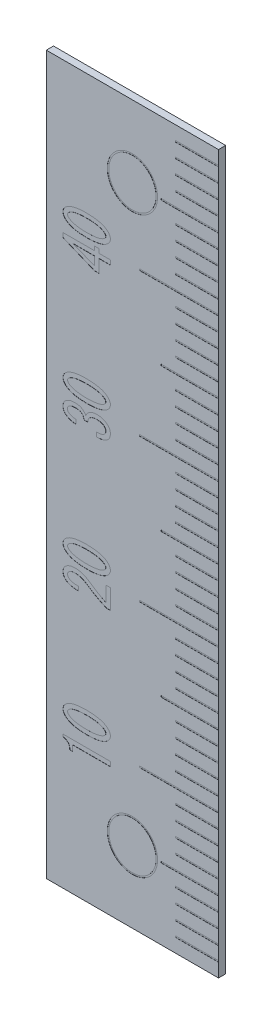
SolidWorks part; units mm, degrees
ref_plane "Front" through (0, 0, 0) normal (0, 0, 1) x (1, 0, 0)
ref_plane "Top" through (0, 0, 0) normal (0, 1, 0) x (1, 0, 0)
ref_plane "Right" through (0, 0, 0) normal (1, 0, 0) x (0, 0, -1)
sketch "Sketch1" plane through (0, 0, 0) normal (0, 0, 1) x (1, 0, 0)
  line L1 (0, 0) -> (0, 50)
  line L2 (0, 0) -> (12, 0)
  line L3 (12, 0) -> (12, 50)
  line L4 (0, 50) -> (12, 50)
  dimension "D1" = 50
  dimension "D2" = 12
extrude "Extrude1" add sketch "Sketch1" along normal blind 0.5
sketch "Sketch2" plane through (0, 0, 0.5) normal (0, 0, 1) x (1, 0, 0)
  line L0 (0, 50) -> (0, 0) construction
  line L1 (0, 0) -> (12, 0) construction
  line L2 (12, 50) -> (0, 50) construction
  circle A0 centre (6, 5) radius 1.75
  circle A1 centre (6, 45) radius 1.75
  circle A2 centre (6, 5) radius 1.65
  circle A3 centre (6, 45) radius 1.65
  dimension "D1" = 6
  dimension "D2" = 6
  dimension "D3" = 5
  dimension "D4" = 5
  dimension "D5" = 3.5
  dimension "D6" = 3.5
  dimension "D7" = 0.1
extrude "Extrude2" cut sketch "Sketch2" against normal blind 0.01
sketch "Sketch3" plane through (0, 0, 0.5) normal (0, 0, 1) x (1, 0, 0)
  line L0 (12, 50) -> (0, 50) construction
  line L1 (1, 38.25) -> (4.5, 38.25) construction
  line L2 (1, 38.25) -> (1, 41.75) construction
  line L3 (1, 41.75) -> (4.5, 41.75) construction
  line L4 (4.5, 38.25) -> (4.5, 41.75) construction
  line L5 (0, 50) -> (0, 0) construction
  line L6 (4.5, 28.25) -> (4.5, 31.75) construction
  line L7 (4.5, 18.25) -> (4.5, 21.75) construction
  line L8 (4.5, 8.25) -> (4.5, 11.75) construction
  text T0 "40" font "ＭＳ ゴシック" height in points 11
  text T1 "30  " font "ＭＳ ゴシック" height in points 11
  text T2 "20" font "ＭＳ ゴシック" height in points 11
  text T3 "10" font "ＭＳ ゴシック" height in points 11
  point P4 (4.5, 40)
  dimension "D1" = 3.5
  dimension "D2" = 10
  dimension "D3" = 1
  dimension "D4" = 3.5
  dimension "D5" = 4
extrude "Extrude3" cut sketch "Sketch3" against normal blind 0.01
sketch "Sketch4" plane through (0, 0, 0.5) normal (0, 0, 1) x (1, 0, 0)
  line L0 (12, 40.05) -> (6.5, 40.05)
  line L1 (12, 0) -> (12, 50) construction
  line L2 (6.5, 40.05) -> (6.5, 39.95)
  line L3 (6.5, 39.95) -> (12, 39.95)
  line L4 (12, 39.95) -> (12, 40.05)
  line L5 (12, 50) -> (0, 50) construction
  line L6 (12, 48.05) -> (12, 47.95)
  line L7 (12, 44.95) -> (8, 44.95)
  line L8 (12, 44.95) -> (12, 45.05)
  line L9 (12, 45.05) -> (8, 45.05)
  line L10 (8, 44.95) -> (8, 45.05)
  line L11 (12, 49.05) -> (9, 49.05)
  line L12 (12, 49.05) -> (12, 48.95)
  line L13 (12, 48.95) -> (9, 48.95)
  line L14 (9, 49.05) -> (9, 48.95)
  line L15 (12, 48.05) -> (9, 48.05)
  line L16 (12, 47.95) -> (9, 47.95)
  line L17 (9, 48.05) -> (9, 47.95)
  line L18 (12, 47.05) -> (12, 46.95)
  line L19 (12, 47.05) -> (9, 47.05)
  line L20 (12, 46.95) -> (9, 46.95)
  line L21 (9, 47.05) -> (9, 46.95)
  line L22 (12, 46.05) -> (12, 45.95)
  line L23 (12, 46.05) -> (9, 46.05)
  line L24 (12, 45.95) -> (9, 45.95)
  line L25 (9, 46.05) -> (9, 45.95)
  line L26 (12, 30.05) -> (6.5, 30.05)
  line L27 (6.5, 30.05) -> (6.5, 29.95)
  line L28 (6.5, 29.95) -> (12, 29.95)
  line L29 (12, 29.95) -> (12, 30.05)
  line L30 (12, 44.05) -> (12, 43.95)
  line L31 (12, 44.05) -> (9, 44.05)
  line L32 (12, 43.95) -> (9, 43.95)
  line L33 (9, 44.05) -> (9, 43.95)
  line L34 (12, 43.05) -> (12, 42.95)
  line L35 (12, 43.05) -> (9, 43.05)
  line L36 (12, 42.95) -> (9, 42.95)
  line L37 (9, 43.05) -> (9, 42.95)
  line L38 (12, 42.05) -> (12, 41.95)
  line L39 (12, 42.05) -> (9, 42.05)
  line L40 (12, 41.95) -> (9, 41.95)
  line L41 (9, 42.05) -> (9, 41.95)
  line L42 (12, 41.05) -> (12, 40.95)
  line L43 (12, 41.05) -> (9, 41.05)
  line L44 (12, 40.95) -> (9, 40.95)
  line L45 (9, 41.05) -> (9, 40.95)
  line L46 (9, 45.05) -> (9, 44.95)
  line L47 (12, 45.05) -> (9, 45.05)
  line L48 (12, 44.95) -> (9, 44.95)
  line L49 (12, 45.05) -> (12, 44.95)
  line L50 (12, 38.05) -> (12, 37.95)
  line L51 (12, 34.95) -> (8, 34.95)
  line L52 (12, 34.95) -> (12, 35.05)
  line L53 (12, 35.05) -> (8, 35.05)
  line L54 (8, 34.95) -> (8, 35.05)
  line L55 (12, 39.05) -> (9, 39.05)
  line L56 (12, 39.05) -> (12, 38.95)
  line L57 (12, 38.95) -> (9, 38.95)
  line L58 (9, 39.05) -> (9, 38.95)
  line L59 (12, 38.05) -> (9, 38.05)
  line L60 (12, 37.95) -> (9, 37.95)
  line L61 (9, 38.05) -> (9, 37.95)
  line L62 (12, 37.05) -> (12, 36.95)
  line L63 (12, 37.05) -> (9, 37.05)
  line L64 (12, 36.95) -> (9, 36.95)
  line L65 (9, 37.05) -> (9, 36.95)
  line L66 (12, 36.05) -> (12, 35.95)
  line L67 (12, 36.05) -> (9, 36.05)
  line L68 (12, 35.95) -> (9, 35.95)
  line L69 (9, 36.05) -> (9, 35.95)
  line L70 (12, 34.05) -> (12, 33.95)
  line L71 (12, 34.05) -> (9, 34.05)
  line L72 (12, 33.95) -> (9, 33.95)
  line L73 (9, 34.05) -> (9, 33.95)
  line L74 (12, 33.05) -> (12, 32.95)
  line L75 (12, 33.05) -> (9, 33.05)
  line L76 (12, 32.95) -> (9, 32.95)
  line L77 (9, 33.05) -> (9, 32.95)
  line L78 (12, 32.05) -> (12, 31.95)
  line L79 (12, 32.05) -> (9, 32.05)
  line L80 (12, 31.95) -> (9, 31.95)
  line L81 (9, 32.05) -> (9, 31.95)
  line L82 (12, 31.05) -> (12, 30.95)
  line L83 (12, 31.05) -> (9, 31.05)
  line L84 (12, 30.95) -> (9, 30.95)
  line L85 (9, 31.05) -> (9, 30.95)
  line L86 (12, 20.05) -> (6.5, 20.05)
  line L87 (6.5, 20.05) -> (6.5, 19.95)
  line L88 (6.5, 19.95) -> (12, 19.95)
  line L89 (12, 19.95) -> (12, 20.05)
  line L90 (12, 28.05) -> (12, 27.95)
  line L91 (12, 24.95) -> (8, 24.95)
  line L92 (12, 24.95) -> (12, 25.05)
  line L93 (12, 25.05) -> (8, 25.05)
  line L94 (8, 24.95) -> (8, 25.05)
  line L95 (12, 29.05) -> (9, 29.05)
  line L96 (12, 29.05) -> (12, 28.95)
  line L97 (12, 28.95) -> (9, 28.95)
  line L98 (9, 29.05) -> (9, 28.95)
  line L99 (12, 28.05) -> (9, 28.05)
  line L100 (12, 27.95) -> (9, 27.95)
  line L101 (9, 28.05) -> (9, 27.95)
  line L102 (12, 27.05) -> (12, 26.95)
  line L103 (12, 27.05) -> (9, 27.05)
  line L104 (12, 26.95) -> (9, 26.95)
  line L105 (9, 27.05) -> (9, 26.95)
  line L106 (12, 26.05) -> (12, 25.95)
  line L107 (12, 26.05) -> (9, 26.05)
  line L108 (12, 25.95) -> (9, 25.95)
  line L109 (9, 26.05) -> (9, 25.95)
  line L110 (12, 24.05) -> (12, 23.95)
  line L111 (12, 24.05) -> (9, 24.05)
  line L112 (12, 23.95) -> (9, 23.95)
  line L113 (9, 24.05) -> (9, 23.95)
  line L114 (12, 23.05) -> (12, 22.95)
  line L115 (12, 23.05) -> (9, 23.05)
  line L116 (12, 22.95) -> (9, 22.95)
  line L117 (9, 23.05) -> (9, 22.95)
  line L118 (12, 22.05) -> (12, 21.95)
  line L119 (12, 22.05) -> (9, 22.05)
  line L120 (12, 21.95) -> (9, 21.95)
  line L121 (9, 22.05) -> (9, 21.95)
  line L122 (12, 21.05) -> (12, 20.95)
  line L123 (12, 21.05) -> (9, 21.05)
  line L124 (12, 20.95) -> (9, 20.95)
  line L125 (9, 21.05) -> (9, 20.95)
  line L126 (12, 10.05) -> (6.5, 10.05)
  line L127 (6.5, 10.05) -> (6.5, 9.95)
  line L128 (6.5, 9.95) -> (12, 9.95)
  line L129 (12, 9.95) -> (12, 10.05)
  line L130 (12, 18.05) -> (12, 17.95)
  line L131 (12, 14.95) -> (8, 14.95)
  line L132 (12, 14.95) -> (12, 15.05)
  line L133 (12, 15.05) -> (8, 15.05)
  line L134 (8, 14.95) -> (8, 15.05)
  line L135 (12, 19.05) -> (9, 19.05)
  line L136 (12, 19.05) -> (12, 18.95)
  line L137 (12, 18.95) -> (9, 18.95)
  line L138 (9, 19.05) -> (9, 18.95)
  line L139 (12, 18.05) -> (9, 18.05)
  line L140 (12, 17.95) -> (9, 17.95)
  line L141 (9, 18.05) -> (9, 17.95)
  line L142 (12, 17.05) -> (12, 16.95)
  line L143 (12, 17.05) -> (9, 17.05)
  line L144 (12, 16.95) -> (9, 16.95)
  line L145 (9, 17.05) -> (9, 16.95)
  line L146 (12, 16.05) -> (12, 15.95)
  line L147 (12, 16.05) -> (9, 16.05)
  line L148 (12, 15.95) -> (9, 15.95)
  line L149 (9, 16.05) -> (9, 15.95)
  line L150 (12, 14.05) -> (12, 13.95)
  line L151 (12, 14.05) -> (9, 14.05)
  line L152 (12, 13.95) -> (9, 13.95)
  line L153 (9, 14.05) -> (9, 13.95)
  line L154 (12, 13.05) -> (12, 12.95)
  line L155 (12, 13.05) -> (9, 13.05)
  line L156 (12, 12.95) -> (9, 12.95)
  line L157 (9, 13.05) -> (9, 12.95)
  line L158 (12, 12.05) -> (12, 11.95)
  line L159 (12, 12.05) -> (9, 12.05)
  line L160 (12, 11.95) -> (9, 11.95)
  line L161 (9, 12.05) -> (9, 11.95)
  line L162 (12, 11.05) -> (12, 10.95)
  line L163 (12, 11.05) -> (9, 11.05)
  line L164 (12, 10.95) -> (9, 10.95)
  line L165 (9, 11.05) -> (9, 10.95)
  line L170 (12, 8.05) -> (12, 7.95)
  line L171 (12, 4.95) -> (8, 4.95)
  line L172 (12, 4.95) -> (12, 5.05)
  line L173 (12, 5.05) -> (8, 5.05)
  line L174 (8, 4.95) -> (8, 5.05)
  line L175 (12, 9.05) -> (9, 9.05)
  line L176 (12, 9.05) -> (12, 8.95)
  line L177 (12, 8.95) -> (9, 8.95)
  line L178 (9, 9.05) -> (9, 8.95)
  line L179 (12, 8.05) -> (9, 8.05)
  line L180 (12, 7.95) -> (9, 7.95)
  line L181 (9, 8.05) -> (9, 7.95)
  line L182 (12, 7.05) -> (12, 6.95)
  line L183 (12, 7.05) -> (9, 7.05)
  line L184 (12, 6.95) -> (9, 6.95)
  line L185 (9, 7.05) -> (9, 6.95)
  line L186 (12, 6.05) -> (12, 5.95)
  line L187 (12, 6.05) -> (9, 6.05)
  line L188 (12, 5.95) -> (9, 5.95)
  line L189 (9, 6.05) -> (9, 5.95)
  line L190 (12, 4.05) -> (12, 3.95)
  line L191 (12, 4.05) -> (9, 4.05)
  line L192 (12, 3.95) -> (9, 3.95)
  line L193 (9, 4.05) -> (9, 3.95)
  line L194 (12, 3.05) -> (12, 2.95)
  line L195 (12, 3.05) -> (9, 3.05)
  line L196 (12, 2.95) -> (9, 2.95)
  line L197 (9, 3.05) -> (9, 2.95)
  line L198 (12, 2.05) -> (12, 1.95)
  line L199 (12, 2.05) -> (9, 2.05)
  line L200 (12, 1.95) -> (9, 1.95)
  line L201 (9, 2.05) -> (9, 1.95)
  line L202 (12, 1.05) -> (12, 0.95)
  line L203 (12, 1.05) -> (9, 1.05)
  line L204 (12, 0.95) -> (9, 0.95)
  line L205 (9, 1.05) -> (9, 0.95)
  line L206 (12, 0.05) -> (6.5, 0.05)
  line L207 (6.5, 0.05) -> (6.5, -0.05)
  line L208 (6.5, -0.05) -> (12, -0.05)
  line L209 (12, -0.05) -> (12, 0.05)
  point P4 (12, 40)
  point P13 (12, 45)
  point P18 (12, 49)
  dimension "D1" = 10
  dimension "D2" = 0.1
  dimension "D3" = 5.5
  dimension "D4" = 5
  dimension "D5" = 0.1
  dimension "D6" = 1
  dimension "D7" = 0.1
  dimension "D8" = 3
  dimension "D9" = 4
  dimension "D10" = 9
  dimension "D11" = 5
extrude "Extrude4" cut sketch "Sketch4" against normal blind 0.01
move or copy body "Body-Move/Copy2" bodies to move or copy 105 copy no translate (-12, 0, 0)
